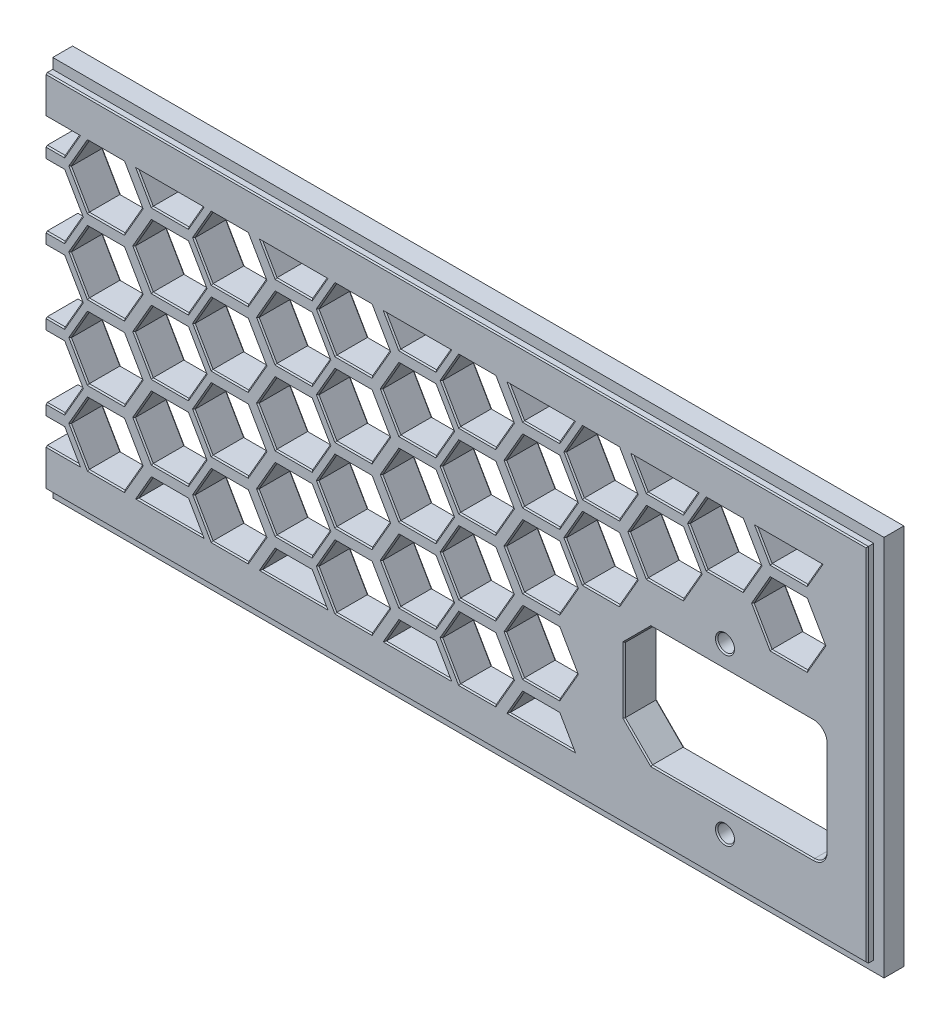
SolidWorks part; units mm, degrees
ref_plane "Aufriss" through (0, 0, 0) normal (0, 0, 1) x (1, 0, 0)
ref_plane "Grundriss" through (0, 0, 0) normal (0, 1, 0) x (1, 0, 0)
ref_plane "Seitenriss" through (0, 0, 0) normal (1, 0, 0) x (0, 0, -1)
sketch "Skizze1" plane through (0, 0, 0) normal (0, 0, 1) x (1, 0, 0)
  line L1 (-192, -43.75) -> (192, -43.75)
  line L2 (-192, -43.75) -> (-192, 43.75)
  line L3 (-192, 43.75) -> (192, 43.75)
  line L4 (192, -43.75) -> (192, 43.75)
  line L5 (-192, -43.75) -> (192, 43.75) construction
  line L6 (-192, 43.75) -> (192, -43.75) construction
  point P0 (0, 0)
  dimension "D1" = 384
  dimension "D2" = 87.5
extrude "Aufsatz-Linear austragen1" add sketch "Skizze1" along normal mid plane 8
sketch "Skizze2" plane through (0, 0, 4) normal (0, 0, 1) x (1, 0, 0)
  line L0 (-192, 43.75) -> (-192, -43.75) construction
  line L1 (-168.1699, 34.5) -> (-176.8301, 34.5)
  line L2 (-176.8301, 34.5) -> (-181.1603, 27)
  line L3 (-181.1603, 27) -> (-176.8301, 19.5)
  line L4 (-176.8301, 19.5) -> (-168.1699, 19.5)
  line L5 (-168.1699, 19.5) -> (-163.8397, 27)
  line L6 (-163.8397, 27) -> (-168.1699, 34.5)
  line L7 (192, 43.75) -> (-192, 43.75) construction
  circle A0 centre (-172.5, 27) radius 7.5 construction
  dimension "D1" = 19.5
  dimension "D2" = 16.75
  dimension "D3" = 15
extrude "Schnitt-Linear austragen1" cut sketch "Skizze2" against normal through all
pattern_linear "Lineares Muster1" count 12 spacing 30 along (1, 0, 0) count 4 spacing 18 along (0, -1, 0) of "Schnitt-Linear austragen1"
sketch "Skizze3" plane through (0, 0, 4) normal (0, 0, 1) x (1, 0, 0)
  line L0 (-168.1699, 34.5) -> (-176.8301, 34.5) construction
  line L1 (-161.3301, 25.5) -> (-165.6603, 18)
  line L2 (-165.6603, 18) -> (-161.3301, 10.5)
  line L3 (-161.3301, 10.5) -> (-152.6699, 10.5)
  line L4 (-152.6699, 10.5) -> (-148.3397, 18)
  line L5 (-148.3397, 18) -> (-152.6699, 25.5)
  line L6 (-152.6699, 25.5) -> (-161.3301, 25.5)
  line L7 (-192, 43.75) -> (-192, -43.75) construction
  line L8 (192, 43.75) -> (-192, 43.75) construction
  circle A0 centre (-157, 18) radius 7.5 construction
  dimension "D1" = 35
  dimension "D2" = 25.75
extrude "Schnitt-Linear austragen2" cut sketch "Skizze3" against normal through all
pattern_linear "Lineares Muster2" count 12 spacing 30 along (1, 0, 0) count 4 spacing 18 along (0, -1, 0) of "Schnitt-Linear austragen2"
pattern_linear "Lineares Muster3" count 2 spacing 18 along (0, 1, 0) count 25 spacing 30 along (1, 0, 0) of "Schnitt-Linear austragen2"
sketch "Skizze4" plane through (0, 0, 4) normal (0, 0, 1) x (1, 0, 0)
  line L0 (192, -43.75) -> (192, 43.75) construction
  line L1 (-192, 43.75) -> (192, 43.75)
  line L3 (-192, 34.5) -> (192, 34.5)
  line L4 (192, 43.75) -> (192, 34.5)
  line L5 (-192, 43.75) -> (-192, -43.75) construction
  line L6 (192, -43.75) -> (-192, -43.75)
  line L7 (192, -43.75) -> (192, -34.5)
  line L8 (192, -34.5) -> (-192, -34.5)
  line L9 (-192, -43.75) -> (-192, -34.5)
  line L11 (-176.8301, -34.5) -> (-168.1699, -34.5) construction
  line L12 (-168.1699, 34.5) -> (-176.8301, 34.5) construction
  line L14 (-192, 34.5) -> (-192, 43.75)
extrude "Aufsatz-Linear austragen2" add sketch "Skizze4" against normal up to surface (8 mm away)
sketch "Skizze5" plane through (0, 0, 0) normal (0, 0, 1) x (1, 0, 0)
  line L1 (-192, 43.75) -> (192, 43.75)
  line L2 (-192, 43.75) -> (-192, -43.75)
  line L3 (-192, -43.75) -> (192, -43.75)
  line L4 (192, 43.75) -> (192, -43.75)
  line L5 (-194.5, 46.25) -> (194.5, 46.25)
  line L6 (-194.5, 46.25) -> (-194.5, -46.25)
  line L7 (-194.5, -46.25) -> (194.5, -46.25)
  line L8 (194.5, 46.25) -> (194.5, -46.25)
  dimension "D1" = 2.5
  dimension "D2" = 2.5
  dimension "D3" = 2.5
  dimension "D4" = 2.5
extrude "Aufsatz-Linear austragen3" add sketch "Skizze5" along normal mid plane 4.8
sketch "Skizze7" plane through (0, 0, 4) normal (0, 0, 1) x (1, 0, 0)
  line L0 (192, -43.75) -> (192, 43.75) construction
  line L1 (139.7, -28.25) -> (133.1, -21.65)
  line L2 (179, -28.25) -> (139.7, -28.25)
  line L3 (139.7, 0.75) -> (179, 0.75)
  line L4 (133.1, -5.85) -> (139.7, 0.75)
  line L5 (133.1, -13.75) -> (182, -13.75) construction
  line L12 (-192, -43.75) -> (192, -43.75) construction
  line L14 (133.1, -21.65) -> (139.7, -28.25)
  line L15 (139.7, -28.25) -> (179, -28.25)
  line L16 (182, -25.25) -> (182, -2.25)
  line L17 (179, 0.75) -> (139.7, 0.75)
  line L18 (139.7, 0.75) -> (133.1, -5.85)
  line L19 (133.1, -5.85) -> (133.1, -21.65)
  arc A0 (182, -25.25) -> (179, -28.25) centre (179, -25.25) cw
  arc A1 (179, 0.75) -> (182, -2.25) centre (179, -2.25) cw
  circle A2 centre (157.55, 6.25) radius 2
  circle A3 centre (157.55, -33.75) radius 2
  arc A8 (179, -28.25) -> (182, -25.25) centre (179, -25.25) ccw
  arc A9 (182, -2.25) -> (179, 0.75) centre (179, -2.25) ccw
  dimension "D2" = 29
  dimension "D4" = 5.5
  dimension "D8" = 45
  dimension "D3" = 24.45
  dimension "D5" = 5.5
  dimension "D7" = 3
  dimension "D11" = 4
  dimension "D1" = 48.9
  dimension "D6" = 10
  dimension "D9" = 6.6
  dimension "D10" = 30
extrude "Schnitt-Linear austragen3" cut sketch "Skizze7" against normal through all contours L19 L5 L16 A1 L3 L4 | A2 | L5 L19 L1 L2 A0 L16 | A3
sketch "Skizze6" plane through (0, 0, 4) normal (0, 0, 1) x (1, 0, 0)
  line L0 (194.5, 46.25) -> (-194.5, 46.25) construction
  line L1 (67.5, -46.25) -> (194.5, -46.25)
  line L2 (67.5, -46.25) -> (67.5, 46.25)
  line L3 (67.5, 46.25) -> (194.5, 46.25)
  line L4 (194.5, -46.25) -> (194.5, 46.25)
  line L8 (71.8301, 34.5) -> (63.1699, 34.5) construction
  point P0 (0, 0)
  point P10 (67.5, 34.5)
chamfer "Fase1" distance 0.3 angle 45
sketch "Skizze8" plane through (0, 0, 4) normal (0, 0, 1) x (1, 0, 0)
  line L0 (-194.5, -46.25) -> (194.5, -46.25) construction
  line L1 (-194.5, 46.25) -> (-7, 46.25)
  line L2 (-194.5, 46.25) -> (-194.5, -46.25)
  line L3 (-194.5, -46.25) -> (-7, -46.25)
  line L4 (-7, 46.25) -> (-7, -46.25)
  line L5 (-11.5033, 25.8) -> (-2.4967, 25.8) construction
  point P9 (-7, 25.8)
extrude "Schnitt-Linear austragen4" cut sketch "Skizze8" against normal through all
